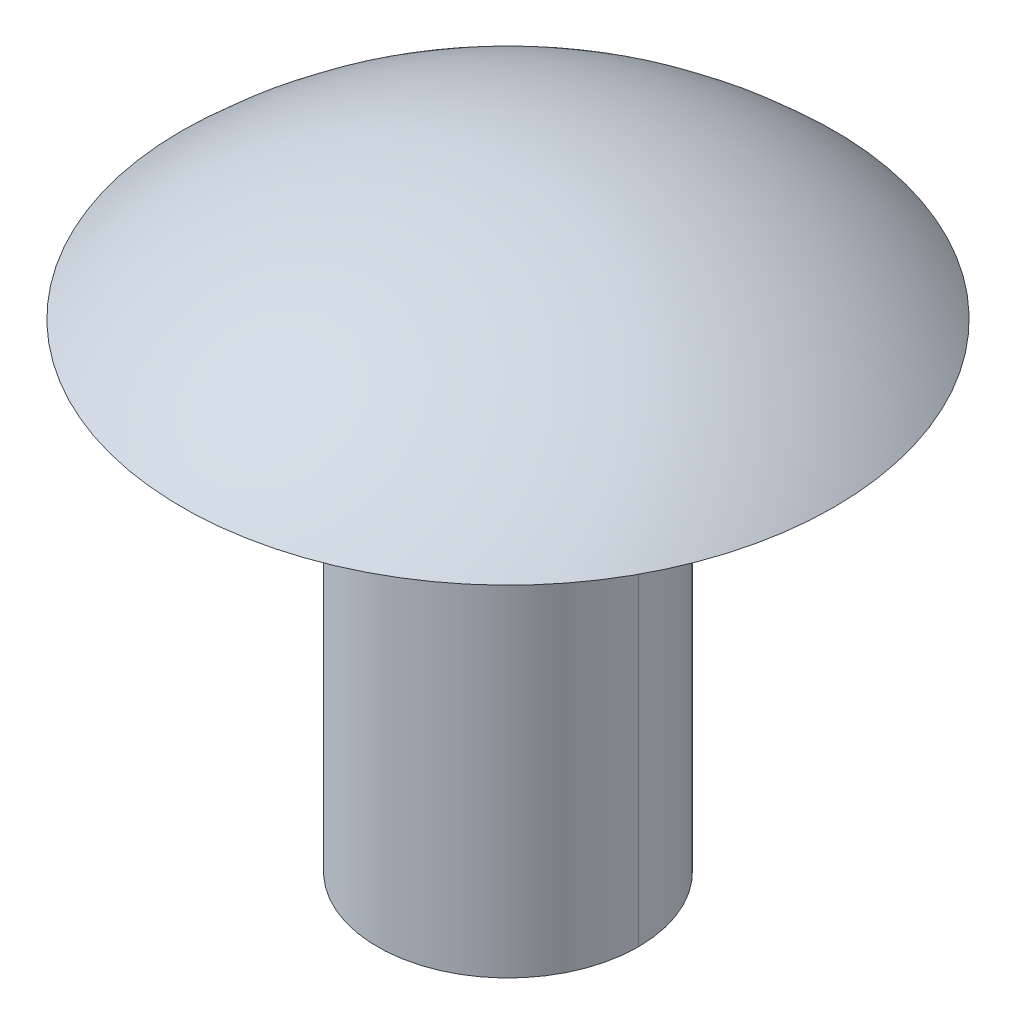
SolidWorks part; units mm, degrees
ref_plane "Front Plane" through (0, 0, 0) normal (0, 0, 1) x (1, 0, 0)
ref_plane "Top Plane" through (0, 0, 0) normal (0, 1, 0) x (1, 0, 0)
ref_plane "Right Plane" through (0, 0, 0) normal (1, 0, 0) x (0, 0, -1)
sketch "Sketch1" plane through (0, 0, 0) normal (0, 1, 0) x (1, 0, 0)
  circle A0 centre (0, 0) radius 4.7625
  dimension "D1" = 9.525
extrude "Boss-Extrude1" add sketch "Sketch1" against normal blind 17.4625
sketch "head diameter" plane through (0, 0, 0) normal (0, 1, 0) x (1, 0, 0)
  circle A0 centre (0, 0) radius 11.8999
  circle A1 centre (0, 0) radius 4.7625 construction
  point P4 (11.8999, 0)
  dimension "D1" = 23.7998
sketch "Sketch3" plane through (0, 0, 0) normal (0, 0, 1) x (1, 0, 0)
  line L0 (0, 4.7498) -> (-9.5218, 4.7498) construction
  line L1 (0, 4.7498) -> (0, 0)
  line L2 (0, 0) -> (11.8999, 0)
  arc A0 (0, 4.7498) -> (11.8999, 0) centre (0, -12.5318) cw
  dimension "D2" = 17.2816
  dimension "D1" = 4.7498
  dimension "D3" = 11.8999
revolve "Revolve1" add sketch "Sketch3" angle 360 about L1
sketch "Sketch5" plane through (0, 0, 0) normal (0, 1, 0) x (1, 0, 0)
  line L0 (-11.8999, 0) -> (11.8999, 0)
  circle A0 centre (0, 0) radius 11.8999 construction
